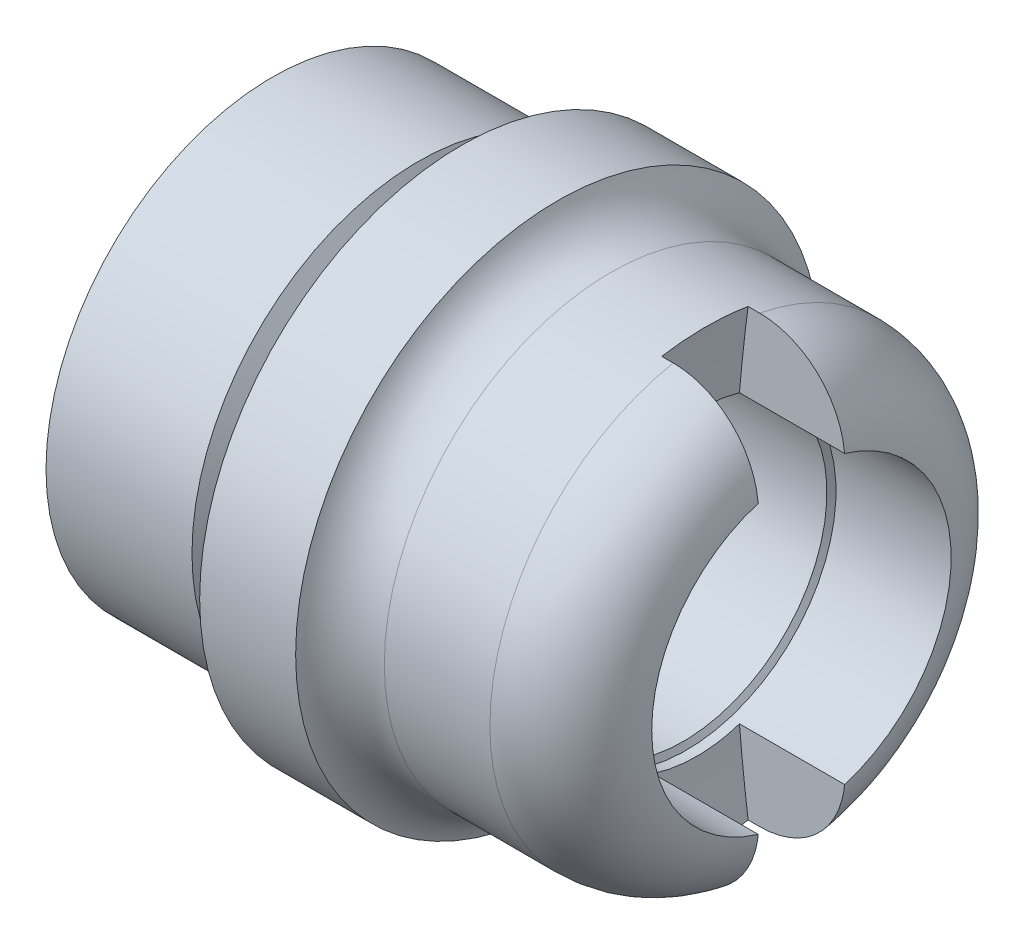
SolidWorks part; units mm, degrees
ref_plane "Front Plane" through (0, 0, 0) normal (0, 0, 1) x (1, 0, 0)
ref_plane "Top Plane" through (0, 0, 0) normal (0, 1, 0) x (1, 0, 0)
ref_plane "Right Plane" through (0, 0, 0) normal (1, 0, 0) x (0, 0, -1)
sketch "Sketch1" plane through (0, 0, 0) normal (0, 0, 1) x (1, 0, 0)
  line L0 (0, 0) -> (50000, 0) construction
  line L1 (0, 2.8448) -> (0, 2.667)
  line L2 (0, 2.667) -> (0.762, 1.905)
  line L3 (0.762, 1.905) -> (5.5186, 1.905)
  line L4 (5.5186, 1.905) -> (5.5626, 1.9812)
  line L5 (5.5626, 1.9812) -> (7.0866, 1.9812)
  line L9 (5.9616, 2.9972) -> (4.5646, 2.9972)
  line L10 (3.8608, 3.4671) -> (2.5908, 3.4671)
  line L11 (2.5908, 3.4671) -> (2.5908, 2.8448)
  line L12 (2.413, 2.667) -> (2.2098, 2.667)
  line L13 (2.2098, 2.667) -> (2.0192, 2.9972)
  line L14 (2.0192, 2.9972) -> (0.088, 2.9972)
  line L15 (0.088, 2.9972) -> (0, 2.8448)
  arc A0 (4.5646, 2.9972) -> (3.8608, 3.4671) centre (4.5646, 3.7592) cw
  arc A1 (5.9616, 2.9972) -> (7.0866, 1.9812) centre (5.9616, 1.8663) cw
  arc A3 (2.5908, 2.8448) -> (2.413, 2.667) centre (2.413, 2.8448) cw
  point P4 (0, 1.905)
  dimension "D1" = 3.9624
  dimension "D4" = 0.1778
  dimension "D10" = 6.9342
  dimension "D11" = 0.762
  dimension "D2" = 60
  dimension "D5" = 5.334
  dimension "D6" = 60
  dimension "D7" = 0.381
  dimension "D8" = 60
  dimension "D9" = 1.27
  dimension "D12" = 5.9944
  dimension "D13" = 3.81
  dimension "D14" = 5.9944
  dimension "D15" = 7.0866
  dimension "D16" = 4.4958
  dimension "D17" = 1.524
revolve "Revolve1" add sketch "Sketch1" angle 360 about L0
sketch "Sketch2" plane through (0, 0, 0) normal (0, 0, 1) x (1, 0, 0)
  line L0 (5.9616, 2.9972) -> (4.5646, 2.9972) construction
  line L1 (5.5626, 1.9812) -> (7.0866, 1.9812) construction
  line L3 (4.5646, -2.9972) -> (5.9616, -2.9972) construction
  line L4 (7.0866, 1.9812) -> (7.0866, -1.9812) construction
  arc A0 (5.8166, 2.9972) -> (5.8166, -2.9972) centre (27.8386, 0) ccw
  spline S0 degree 3 poles (5.8166, -2.9972) (6.0359, -4.6084) (10.8424, -5.7227) (12.2592, 3.3798) (6.0921, 5.024) (5.9044, 3.6424) (5.8166, 2.9972) knots 0 0 0 0 0.189466 0.713226 0.914655 1 1 1 1
  point P3 (5.7021, 1.9812)
  dimension "D1" = 22.225
  dimension "D2" = 1.27
extrude "Cut-Extrude1" cut sketch "Sketch2" against normal mid plane 1.143
